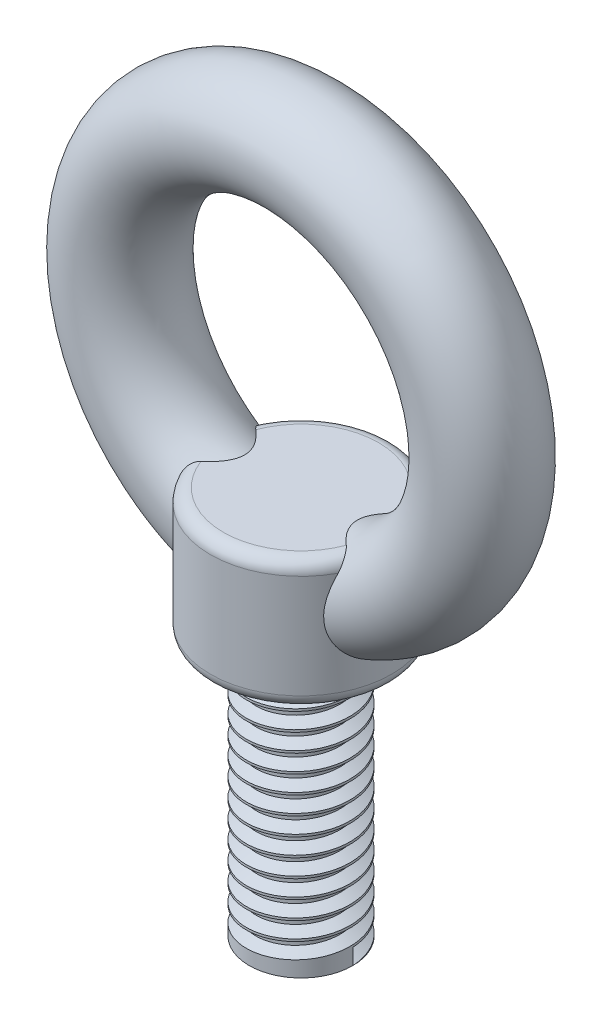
SolidWorks part; units mm, degrees
ref_plane "Front Plane" through (0, 0, 0) normal (0, 0, 1) x (1, 0, 0)
ref_plane "Top Plane" through (0, 0, 0) normal (0, 1, 0) x (1, 0, 0)
ref_plane "Right Plane" through (0, 0, 0) normal (1, 0, 0) x (0, 0, -1)
sketch "Sketch2" plane through (0, 0, 0) normal (0, 0, 1) x (1, 0, 0)
  circle A0 centre (0, 7) radius 7
  dimension "D1" = 14
sketch "Sketch3" plane through (0, 0, 0) normal (1, 0, 0) x (0, 0, -1)
  circle A0 centre (0, 0) radius 2
  dimension "D1" = 4
sweep "Sweep1" add profiles "Sketch3" path "Sketch2"
sketch "Sketch4" plane through (0, 0, 0) normal (0, 1, 0) x (1, 0, 0)
  circle A0 centre (0, 0) radius 3.5
  dimension "D1" = 7
extrude "Boss-Extrude1" add sketch "Sketch4" along normal mid plane 5
sketch "Sketch5" plane through (0, -2.5, 0) normal (0, -1, 0) x (1, 0, 0)
  circle A0 centre (0, 0) radius 2
  dimension "D1" = 4
extrude "Boss-Extrude2" add sketch "Sketch5" along normal blind 10
fillet "Fillet1" radius 0.5 7 edges at (7.7912, 2.5, -0.1027) (3.4997, -1.2912, -0.0437) (-7.7912, 2.5, 0.102) (-3.4997, -1.2912, 0.0437) (0, -2.5, 3.5) (0, 2.5, -3.5) (0, 2.5, 3.5)
thread "Thread1" pitch 0.7 start angle 0, offset 0, length 10, pitch 0.7, diameter 4
ref_plane "Plane1" through (2, -12.5, 0) normal (0, 0, 1) x (1, 0, 0)
sketch "Thread Profile1" plane through (2, -12.5, 0) normal (0, 0, 1) x (1, 0, 0)
  line L0 (0, 0) -> (0, 0.7) construction
  line L11 (0, 0) -> (0, 0.6125)
  line L12 (0, 0.6125) -> (-0.3789, 0.3937)
  line L13 (-0.3789, 0.3937) -> (-0.3789, 0.2187)
  line L15 (-0.3789, 0.2187) -> (0, 0)
  line L17 (-0.3789, 0.3062) -> (0, 0.3062) construction
  point P2 (0, 0)
  dimension "Pitch" = 0.7
  dimension "Profile_Angle" = 60
  dimension "Profile_Land" = 0.175
  dimension "Profile_Height" = 0.3789
